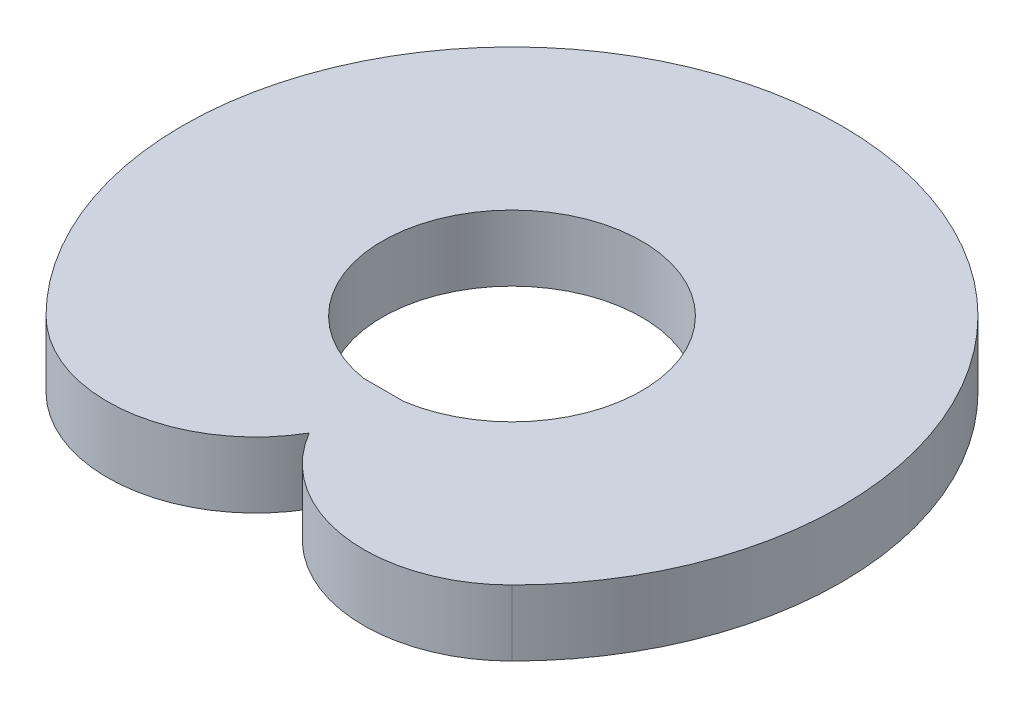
SolidWorks part; units mm, degrees
ref_plane "前视基准面" through (0, 0, 0) normal (0, 0, 1) x (1, 0, 0)
ref_plane "上视基准面" through (0, 0, 0) normal (0, 1, 0) x (1, 0, 0)
ref_plane "右视基准面" through (0, 0, 0) normal (1, 0, 0) x (0, 0, -1)
sketch "草图1" plane through (0, 0, 0) normal (0, 1, 0) x (1, 0, 0)
  line L0 (0, 0) -> (0, 825) construction
  line L1 (0, 0) -> (-707.1068, -707.1068) construction
  line L2 (0, 0) -> (707.1068, -707.1068) construction
  line L3 (0, 550) -> (318.1981, 231.8019) construction
  line L4 (0, 550) -> (-318.1981, 231.8019) construction
  line L5 (61.0913, -388.9087) -> (-61.0913, -388.9087)
  circle A0 centre (0, 0) radius 550 construction
  circle A1 centre (0, 550) radius 450 construction
  arc A2 (707.1068, -707.1068) -> (-707.1068, -707.1068) centre (0, 0) ccw
  arc A4 (-707.1068, -707.1068) -> (0, -615.2934) centre (-388.9087, -388.9087) ccw
  arc A5 (0, -615.2934) -> (707.1068, -707.1068) centre (388.9087, -388.9087) ccw
  arc A7 (61.0913, -388.9087) -> (-61.0913, -388.9087) centre (0, 0) ccw
  dimension "D1" = 1100
  dimension "D2" = 900
  dimension "D4" = 135
  dimension "D3" = 1000
  dimension "D8" = 135
  dimension "D5" = 135
  dimension "D6" = 135
  dimension "D7" = 135
extrude "凸台-拉伸1" add sketch "草图1" along normal blind 200
